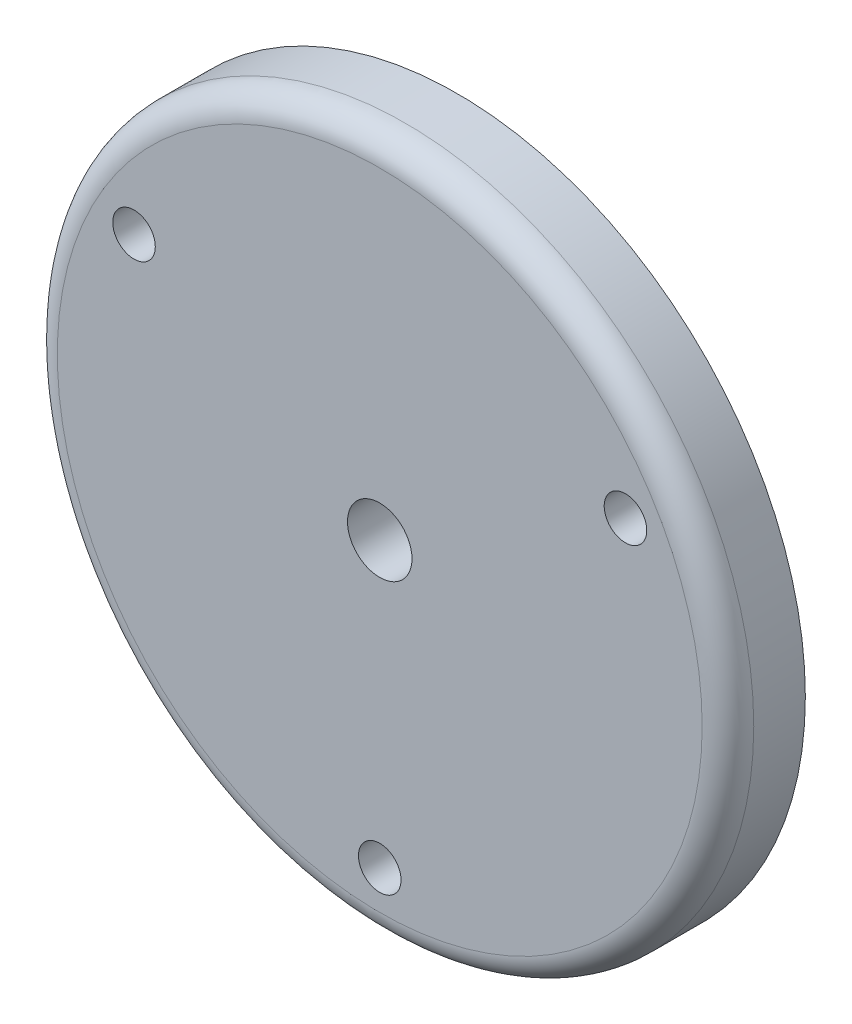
SolidWorks part; units mm, degrees
ref_plane "前视基准面" through (0, 0, 0) normal (0, 0, 1) x (1, 0, 0)
ref_plane "上视基准面" through (0, 0, 0) normal (0, 1, 0) x (1, 0, 0)
ref_plane "右视基准面" through (0, 0, 0) normal (1, 0, 0) x (0, 0, -1)
ref_plane "基准面1" through (0, 0, 2) normal (0, 0, 1) x (1, 0, 0)
sketch "草图1" plane through (0, 0, 2) normal (0, 0, 1) x (1, 0, 0)
  circle A0 centre (3, 52) radius 27
  circle A1 centre (3, 52) radius 27 construction
extrude "拉伸1" add sketch "草图1" along normal blind 6
sketch "草图2" plane through (0, 0, 2) normal (0, 0, -1) x (-1, 0, 0)
  circle A0 centre (-3, 52) radius 17.5 construction
  circle A3 centre (-3, 52) radius 17.5
  circle A4 centre (-3, 52) radius 14
  dimension "D1" = 28
extrude "拉伸2" add sketch "草图2" along normal blind 4
sketch "草图3" plane through (0, 0, 0) normal (0, 0, 1) x (1, 0, 0)
  circle A0 centre (3, 30) radius 1.65 construction
  circle A1 centre (22.0526, 63) radius 1.65 construction
  circle A2 centre (-16.0526, 63) radius 1.65 construction
  circle A3 centre (3, 30) radius 1.65
  circle A4 centre (22.0526, 63) radius 1.65
  circle A5 centre (-16.0526, 63) radius 1.65
extrude "切除-拉伸2" cut sketch "草图3" along normal through all
hole_wizard "M6 螺纹孔1" positions "草图6" profile "草图5" tap size "M6" standard "ISO"
sketch "草图6" plane through (0, 0, 8) normal (0, 0, 1) x (1, 0, 0)
  point P1 (3, 52)
sketch "草图5" plane through (3, 52, 8) normal (1, 0, 0) x (0, -1, 0)
  line L0 (0, 0) -> (0, 17.5022)
  line L1 (0, 17.5022) -> (2.5, 16)
  line L2 (2.5, 16) -> (2.5, 0)
  line L5 (2.5, 0) -> (0, 0)
  line L10 (0, 17.5022) -> (-2.5, 16) construction
  line L11 (0, -6.35) -> (0, 107.95) construction
  dimension "蹟恇謂郰芛眻噤" = 5
  dimension "蹟恇謂郰芛旮僅" = 16
  dimension "絳芛褒僅" = 118
fillet "圆角1" radius 2 1 edges at (30, 52, 8)
